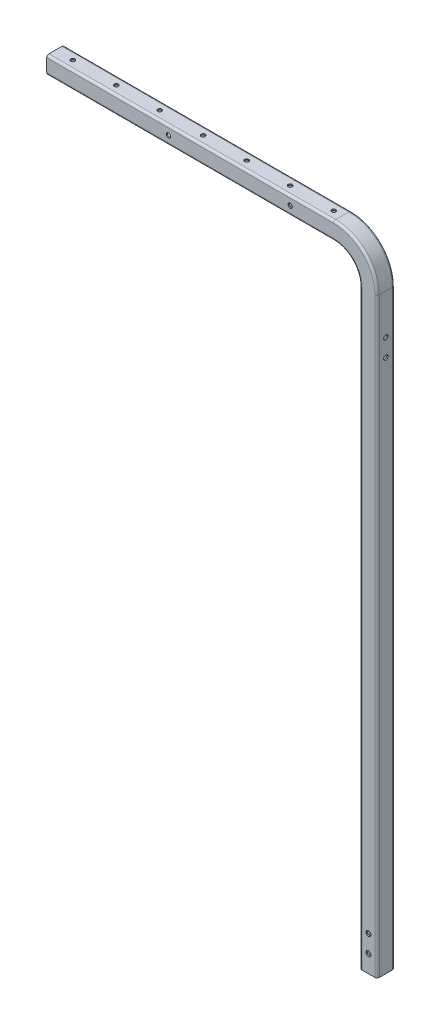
SolidWorks part; units mm, degrees
ref_plane "Front" through (0, 0, 0) normal (0, 0, 1) x (1, 0, 0)
ref_plane "Top" through (0, 0, 0) normal (0, 1, 0) x (1, 0, 0)
ref_plane "Right" through (0, 0, 0) normal (1, 0, 0) x (0, 0, -1)
sketch "Sketch1" plane through (0, 0, 0) normal (0, 0, 1) x (1, 0, 0)
  line L0 (0, 0) -> (419.1, 0)
  line L1 (469.9, -50.8) -> (469.9, -914.4)
  arc A0 (469.9, -50.8) -> (419.1, 0) centre (419.1, -50.8) ccw
  dimension "D1" = 50.8
  dimension "D2" = 469.9
  dimension "D3" = 914.4
sketch "Sketch2"
  line L0 (-12.7, 12.7) -> (12.7, 12.7)
  line L1 (-12.7, 12.7) -> (-12.7, -12.7)
  line L2 (12.7, -12.7) -> (-12.7, -12.7)
  line L3 (12.7, -12.7) -> (12.7, 12.7)
  line L4 (12.7, 12.7) -> (-12.7, -12.7) construction
  dimension "square" = 25.4
sweep "Base-Sweep" add profiles "Sketch2" path "Sketch1"
fillet "Fillet1" radius 3.175 12 edges at (464.0013, -5.8987, 12.7) (464.0013, -5.8987, -12.7) (446.0408, -23.8592, -12.7) (446.0408, -23.8592, 12.7) (482.6, -482.6, 12.7) (482.6, -482.6, -12.7) (457.2, -482.6, -12.7) (457.2, -482.6, 12.7) (209.55, 12.7, 12.7) (209.55, 12.7, -12.7) (209.55, -12.7, -12.7) (209.55, -12.7, 12.7)
shell "Shell1" thickness 1.5875
hole_wizard "Ø6.0 (6) Diameter Hole1" positions "Sketch9" profile "Sketch10" hole size "Ø6.0" standard "ANSI Metric"
sketch "Sketch9" plane through (0, 12.7, 0) normal (0, 1, 0) x (1, 0, 0)
  line L0 (406.4, 0) -> (419.1, 0) construction
  line L1 (419.1, -9.525) -> (419.1, 9.525) construction
  point P0 (406.4, 0)
  dimension "D1" = 12.7
sketch "Sketch10" plane through (406.4, 12.7, 0) normal (1, 0, 0) x (0, 0, 1)
  line L0 (0, 0) -> (0, 927.1)
  line L1 (0, 927.1) -> (3, 927.1)
  line L2 (3, 927.1) -> (3, 0)
  line L5 (3, 0) -> (0, 0)
  line L11 (0, -6.35) -> (0, 107.95) construction
  dimension "Thru Hole Dia." = 6
  dimension "Thru Hole Depth" = 927.1
pattern_linear "LPattern3" count 7 spacing 63.5 along (-1, 0, 0) of "Ø6.0 (6) Diameter Hole1"
sketch "Sketch5" plane through (482.6, 0, 0) normal (1, 0, 0) x (0, 0, -1)
  line L4 (-9.525, 12.7) -> (9.525, 12.7) construction
  line L5 (0, 50) -> (0, -50) construction
  circle A4 centre (0, -109.5375) radius 3.175
  circle A5 centre (0, -134.9375) radius 3.175
  dimension "D1" = 122.2375
  dimension "D3" = 6.35
  dimension "D2" = 25.4
extrude "cont_mtg" cut sketch "Sketch5" against normal through all
hole_wizard "1/4 (0.25) Diameter Hole1" positions "Sketch7" profile "Sketch6" hole size "1/4" standard "Ansi Inch"
sketch "Sketch7" plane through (0, 0, 12.7) normal (0, 0, 1) x (1, 0, 0)
  line L1 (0, 9.525) -> (0, -9.525) construction
  line L2 (0, 0) -> (419.1, 0) construction
  point P0 (177.8, 0)
  point P1 (355.6, 0)
  dimension "D1" = 177.8
  dimension "D2" = 355.6
sketch "Sketch6" plane through (177.8, 0, 12.7) normal (1, 0, 0) x (0, -1, 0)
  line L0 (0, 0) -> (0, 25.4)
  line L1 (0, 25.4) -> (3.175, 25.4)
  line L2 (3.175, 25.4) -> (3.175, 0)
  line L5 (3.175, 0) -> (0, 0)
  line L11 (0, -6.35) -> (0, 107.95) construction
  dimension "Thru Hole Dia." = 6.35
  dimension "Thru Hole Depth" = 25.4
sketch "Sketch8" plane through (0, 0, -12.7) normal (0, 0, -1) x (-1, 0, 0)
  line L1 (-460.375, -914.4) -> (-479.425, -914.4) construction
  line L2 (-469.9, -50.8) -> (-469.9, -914.4) construction
  circle A1 centre (-469.9, -889) radius 3.5719
  dimension "D1" = 7.1437
  dimension "D3" = 25.4
extrude "Cut-Extrude1" cut sketch "Sketch8" against normal through all
pattern_linear "LPattern2" count 2 spacing 25.4 along (0, 1, 0) of "Cut-Extrude1"
